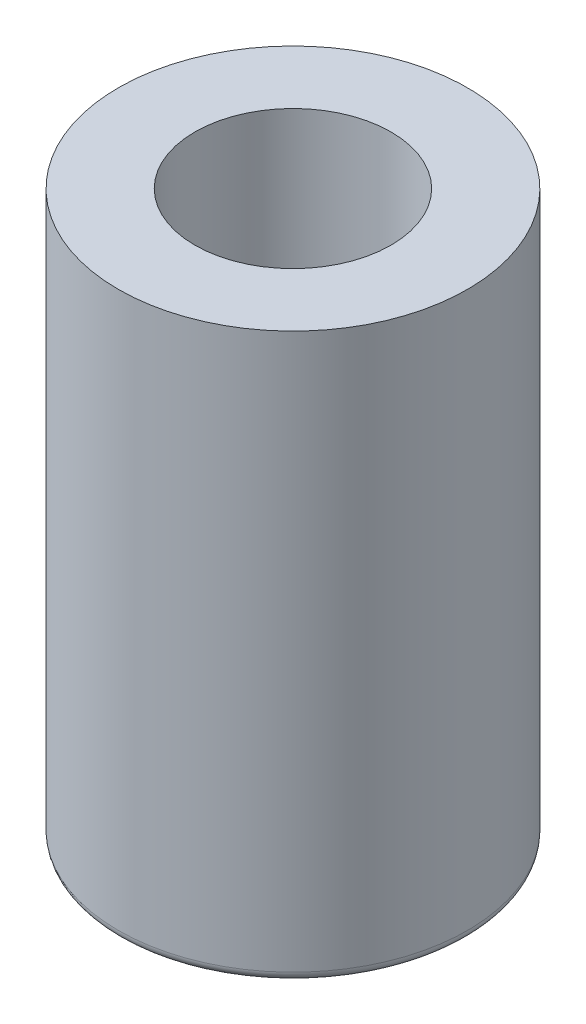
SolidWorks part; units mm, degrees
ref_plane "Face" through (0, 0, 0) normal (0, 0, 1) x (1, 0, 0)
ref_plane "Dessus" through (0, 0, 0) normal (0, 1, 0) x (1, 0, 0)
ref_plane "Droite" through (0, 0, 0) normal (1, 0, 0) x (0, 0, -1)
sketch "Esquisse1" plane through (0, 0, 0) normal (0, 1, 0) x (1, 0, 0)
  circle A0 centre (0, 0) radius 44.5
  dimension "D1" = 89
extrude "Brut" add sketch "Esquisse1" along normal blind 144
sketch "Esquisse2" plane through (0, 144, 0) normal (0, 1, 0) x (1, 0, 0)
  circle A0 centre (0, 0) radius 25
  dimension "D1" = 50
extrude "Alésage" cut sketch "Esquisse2" against normal through all
fillet "Arrondi" radius 2.5 1 edges at (0, 0, 44.5)
